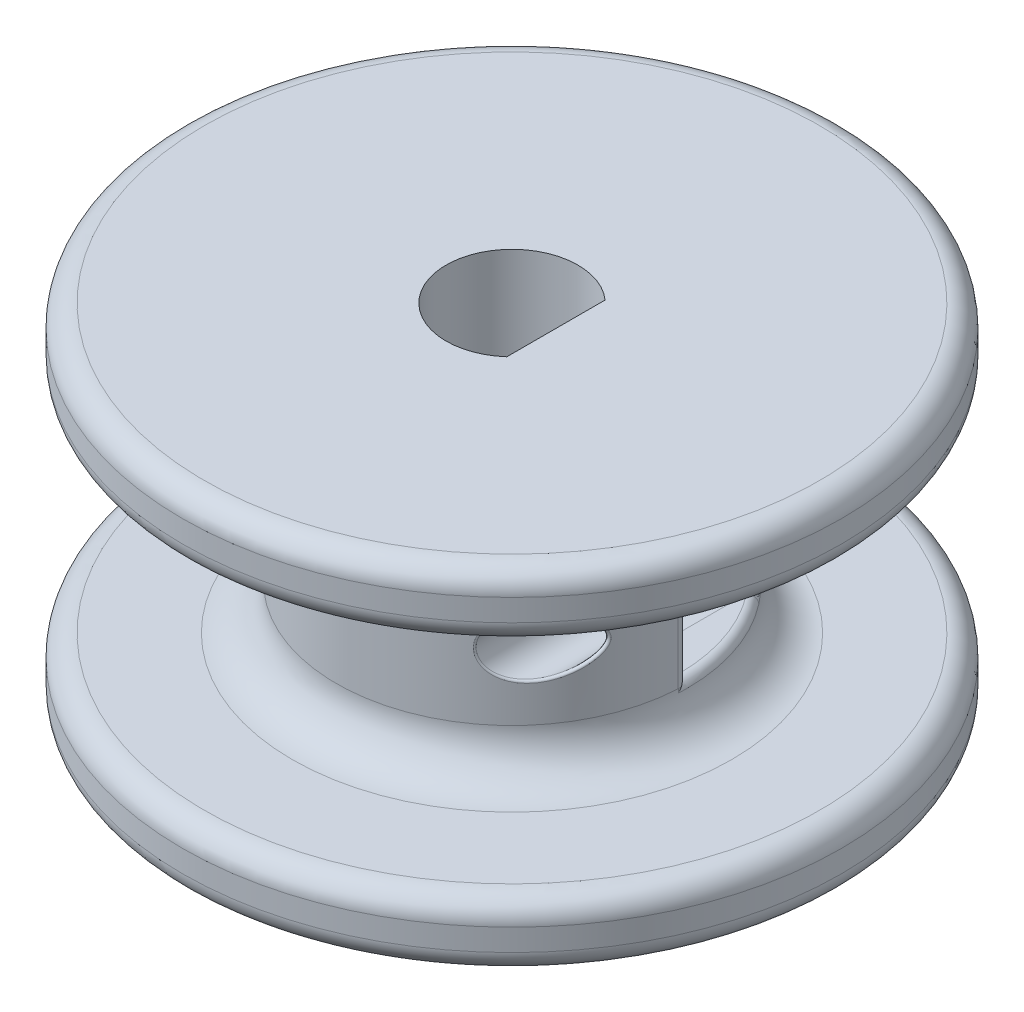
SolidWorks part; units mm, degrees
ref_plane "Front Plane" through (0, 0, 0) normal (0, 0, 1) x (1, 0, 0)
ref_plane "Top Plane" through (0, 0, 0) normal (0, 1, 0) x (1, 0, 0)
ref_plane "Right Plane" through (0, 0, 0) normal (1, 0, 0) x (0, 0, -1)
sketch "Sketch2" plane through (0, 0, 0) normal (0, 0, 1) x (1, 0, 0)
  line L0 (0, 4) -> (7.5, 4)
  line L1 (7.5, 4) -> (7.5, 2.5)
  line L2 (4, 1.5) -> (4, 0)
  line L3 (0, 4) -> (0, 0)
  line L4 (0, 0) -> (4, 0)
  line L5 (0, -411.591) -> (0, 20167.9594) construction
  line L6 (7.5, 2.5) -> (5, 2.5)
  arc A1 (5, 2.5) -> (4, 1.5) centre (5, 1.5) ccw
  dimension "D3" = 1.5
  dimension "D5" = 1
  dimension "D1" = 15
  dimension "D2" = 8
  dimension "D4" = 4
revolve "Revolve1" add sketch "Sketch2" angle 360 about L5
mirror "Mirror1" about plane through (0, 0, 0) normal (0, -1, 0) of "Revolve1"
sketch "Sketch3" plane through (0, 4, 0) normal (0, 1, 0) x (1, 0, 0)
  line L0 (1, 1.118) -> (1, -1.118)
  arc A0 (1, 1.118) -> (1, -1.118) centre (0, 0) ccw
  dimension "D1" = 3
  dimension "D2" = 1
extrude "Cut-Extrude1" cut sketch "Sketch3" against normal through all
sketch "Sketch4" plane through (0, 0, 0) normal (0, 0, 1) x (1, 0, 0)
  circle A0 centre (3, 0) radius 0.625
  dimension "D1" = 1.25
  dimension "D2" = 2
extrude "Cut-Extrude2" cut sketch "Sketch4" against normal through all both and the other way through all
sketch "Sketch5" plane through (0, 0, 0) normal (0, 0, 1) x (1, 0, 0)
  line L0 (3, 1.4) -> (5.144, 1.4)
  line L1 (5.144, 1.4) -> (5.144, -1.4)
  line L2 (5.144, -1.4) -> (3, -1.4)
  arc A0 (3, 1.4) -> (3, -1.4) centre (3, 0) ccw
  dimension "D1" = 2.8
extrude "Cut-Extrude7" cut sketch "Sketch5" against normal through all
fillet "Fillet1" radius 0.5 4 edges at (7.5, 2.5, 0) (7.5, 4, 0) (7.5, -2.5, 0) (7.5, -4, 0)
fillet "Fillet2" radius 0.2 4 edges at (3.7417, -1.4, -1.4142) (3.7417, 1.4, -1.4142) (4, 0, 0) (1.6066, 0.1355, -3.6632)
fillet "Fillet3" radius 0.05 1 edges at (2.3774, -0.0552, 3.2168)
